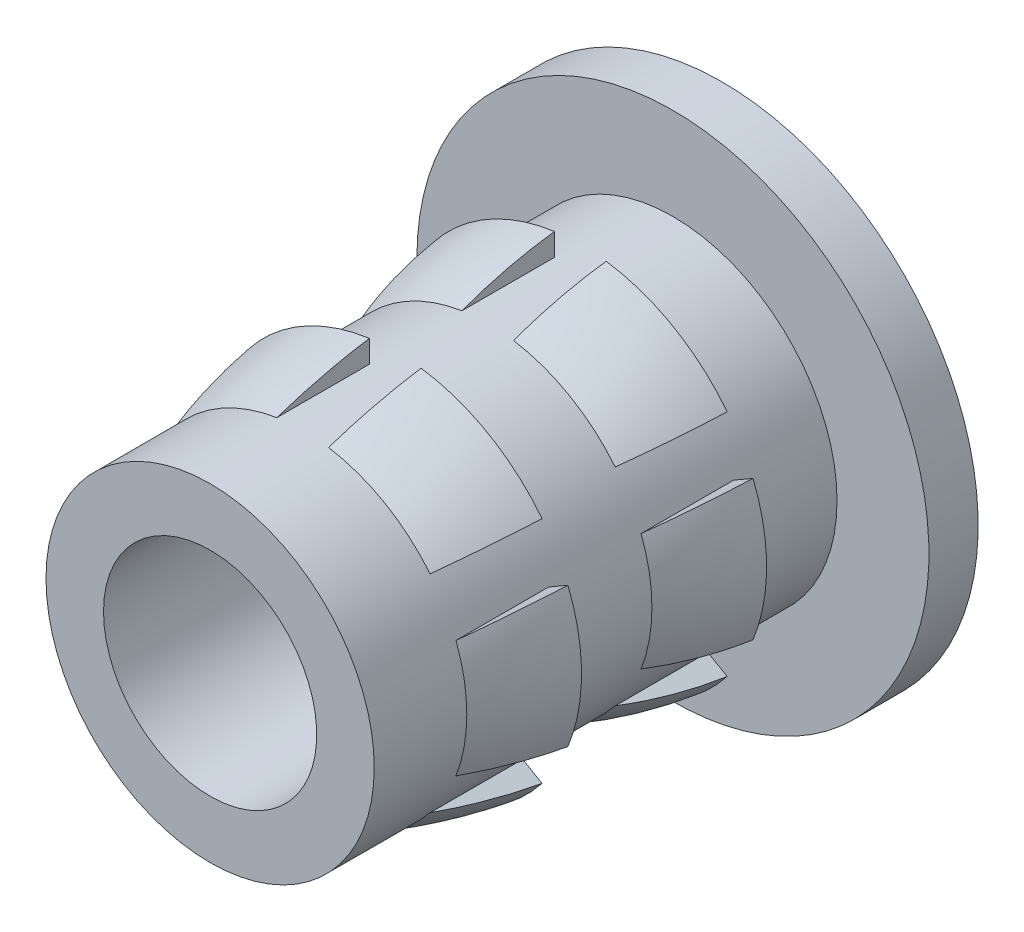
SolidWorks part; units mm, degrees
other "<flanged insert M4X0.7>-<M4x0.7 Tapped Hole1>"
ref_plane "Front Plane" through (0, 0, 0) normal (0, 0, 1) x (1, 0, 0)
ref_plane "Top Plane" through (0, 0, 0) normal (0, 1, 0) x (1, 0, 0)
ref_plane "Right Plane" through (0, 0, 0) normal (1, 0, 0) x (0, 0, -1)
inserted part "flanged insert M4X0.7"
